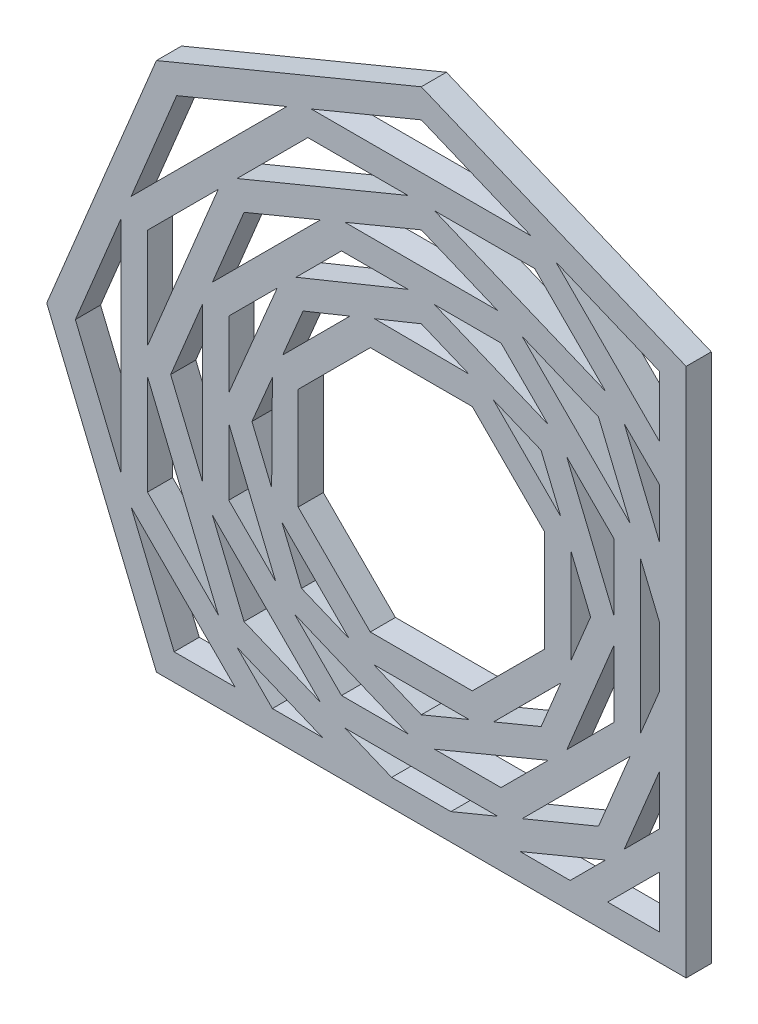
SolidWorks part; units mm, degrees
ref_plane "Front Plane" through (0, 0, 0) normal (0, 0, 1) x (1, 0, 0)
ref_plane "Top Plane" through (0, 0, 0) normal (0, 1, 0) x (1, 0, 0)
ref_plane "Right Plane" through (0, 0, 0) normal (1, 0, 0) x (0, 0, -1)
sketch "Sketch1" plane through (0, 0, 0) normal (0, 0, 1) x (1, 0, 0)
  line L54 (-570.6141, 528.2053) -> (-770.6141, 445.3626)
  line L216 (-770.6141, 445.3626) -> (-853.4568, 245.3626)
  line L270 (-853.4568, 245.3626) -> (-770.6141, 45.3626)
  line L278 (-370.6141, 445.3626) -> (-370.6141, 45.3626)
  line L286 (-770.6141, 45.3626) -> (-370.6141, 45.3626)
  line L303 (-370.6141, 445.3626) -> (-570.6141, 528.2053)
extrude "Boss-Extrude3" add sketch "Sketch1" along normal blind 19
sketch "Sketch2" plane through (0, 0, 19) normal (0, 0, 1) x (1, 0, 0)
  line L1 (-532.0943, 338.3279) -> (-609.1141, 338.3316)
  line L2 (-609.1141, 338.3316) -> (-663.5779, 283.8729)
  line L3 (-663.5779, 283.8729) -> (-663.5815, 206.8531)
  line L4 (-663.5815, 206.8531) -> (-609.1229, 152.3893)
  line L5 (-609.1229, 152.3893) -> (-532.1031, 152.3856)
  line L6 (-532.1031, 152.3856) -> (-477.6393, 206.8443)
  line L7 (-789.731, 143.7775) -> (-757.2505, 65.3626)
  line L8 (-477.6393, 206.8443) -> (-477.6356, 283.8641)
  line L9 (-477.6356, 283.8641) -> (-532.0943, 338.3279)
  line L10 (-412.8933, 169.2086) -> (-494.4601, 87.6417)
  line L11 (-630.8302, 390.7371) -> (-580.6141, 390.7371)
  line L12 (-680.4805, 149.6383) -> (-715.9886, 185.1465)
  line L13 (-465.2093, 191.0436) -> (-480.0941, 155.049)
  line L15 (-757.2505, 65.3626) -> (-711.3162, 65.3626)
  line L16 (-429.912, 65.3626) -> (-390.6141, 65.3626)
  line L17 (-431.4763, 92.0826) -> (-495.9842, 65.3626)
  line L18 (-436.7836, 111.5321) -> (-494.4601, 87.6417)
  line L19 (-510.398, 390.7371) -> (-474.8899, 355.229)
  line L20 (-570.5915, 373.2221) -> (-534.6332, 358.3276)
  line L21 (-659.8913, 336.92) -> (-624.4913, 351.271)
  line L22 (-797.3847, 328.4701) -> (-797.3847, 162.2551)
  line L23 (-672.1992, 464.4795) -> (-755.3068, 430.0553)
  line L24 (-759.879, 245.3626) -> (-735.9886, 303.039)
  line L25 (-709.7519, 92.0826) -> (-683.0319, 65.3626)
  line L26 (-412.8933, 169.2086) -> (-436.7836, 111.5321)
  line L27 (-728.335, 321.5166) -> (-704.4446, 379.1931)
  line L28 (-605.9776, 358.837) -> (-570.5915, 373.2221)
  line L30 (-390.6141, 357.7804) -> (-417.3341, 384.5004)
  line L31 (-777.3847, 159.7154) -> (-723.8941, 106.2248)
  line L32 (-672.1992, 464.4795) -> (-789.731, 346.9477)
  line L33 (-777.3847, 331.0098) -> (-777.3847, 255.3626)
  line L34 (-709.7519, 398.6426) -> (-580.6141, 452.1332)
  line L35 (-723.8941, 106.2248) -> (-777.3847, 235.3626)
  line L36 (-777.3847, 235.3626) -> (-777.3847, 159.7154)
  line L37 (-480.0941, 155.049) -> (-516.1165, 140.1033)
  line L38 (-516.1566, 350.6744) -> (-465.2981, 299.811)
  line L39 (-605.9916, 358.8711) -> (-534.633, 358.3281)
  line L40 (-675.9344, 190.9256) -> (-675.9348, 190.9254)
  line L41 (-570.6141, 506.5575) -> (-653.7216, 472.1332)
  line L42 (-429.912, 65.3626) -> (-390.6141, 104.6605)
  line L43 (-417.3341, 384.5004) -> (-390.6141, 319.9925)
  line L44 (-390.6141, 222.9952) -> (-405.2396, 187.6861)
  line L45 (-715.9886, 185.1465) -> (-715.9886, 235.3626)
  line L46 (-474.7891, 135.597) -> (-560.6141, 99.9881)
  line L47 (-665.2269, 356.3404) -> (-630.8302, 390.7371)
  line L48 (-457.5986, 209.4479) -> (-457.5665, 209.4345)
  line L49 (-487.5066, 472.1332) -> (-570.6141, 506.5575)
  line L50 (-512.9377, 79.9881) -> (-628.2906, 79.9881)
  line L51 (-425.2396, 305.5787) -> (-425.2396, 255.3626)
  line L52 (-405.2396, 303.039) -> (-390.6141, 267.73)
  line L53 (-465.2093, 191.0436) -> (-516.1033, 140.0711)
  line L54 (-625.0593, 140.0457) -> (-661.031, 154.9457)
  line L55 (-679.3118, 342.3388) -> (-679.2704, 342.2969)
  line L56 (-777.3847, 255.3626) -> (-723.8941, 384.5004)
  line L57 (-646.7681, 87.6417) -> (-704.4446, 111.5321)
  line L58 (-580.6141, 99.9881) -> (-666.3384, 135.4962)
  line L59 (-683.5877, 209.4022) -> (-683.045, 281.9239)
  line L60 (-665.2269, 356.3404) -> (-580.6141, 390.7371)
  line L62 (-390.6141, 170.7326) -> (-390.6141, 132.9448)
  line L63 (-656.2613, 452.1332) -> (-709.7519, 398.6426)
  line L64 (-704.4446, 379.1931) -> (-646.7681, 403.0834)
  line L65 (-510.398, 99.9881) -> (-560.6141, 99.9881)
  line L66 (-570.6122, 117.493) -> (-606.5828, 132.3925)
  line L67 (-625.0593, 140.0457) -> (-675.9348, 190.9254)
  line L68 (-457.6452, 281.3342) -> (-442.7461, 245.3645)
  line L70 (-728.335, 321.5166) -> (-646.7681, 403.0834)
  line L71 (-628.2906, 410.7371) -> (-512.9377, 410.7371)
  line L72 (-723.8941, 384.5004) -> (-777.3847, 331.0098)
  line L73 (-661.031, 154.9457) -> (-675.9344, 190.9256)
  line L74 (-675.3378, 300.3792) -> (-624.4913, 351.271)
  line L75 (-460.7477, 341.0868) -> (-425.2396, 305.5787)
  line L76 (-683.5877, 209.4022) -> (-698.4914, 245.383)
  line L78 (-494.4601, 403.0834) -> (-412.8933, 321.5166)
  line L79 (-390.6141, 170.7326) -> (-417.3341, 106.2248)
  line L80 (-735.9886, 187.6861) -> (-735.9886, 303.039)
  line L81 (-560.6141, 390.7371) -> (-474.8899, 355.229)
  line L82 (-628.2906, 410.7371) -> (-570.6141, 434.6275)
  line L83 (-516.1165, 140.1033) -> (-516.1033, 140.0711)
  line L84 (-484.9669, 452.1332) -> (-560.6141, 452.1332)
  line L85 (-390.6141, 357.7804) -> (-390.6141, 319.9925)
  line L86 (-534.633, 358.3281) -> (-534.6332, 358.3276)
  line L87 (-417.3341, 106.2248) -> (-390.6141, 132.9448)
  line L88 (-715.9886, 305.5787) -> (-679.2704, 342.2969)
  line L89 (-715.9886, 255.3626) -> (-715.9886, 305.5787)
  line L90 (-460.7476, 149.6385) -> (-460.7062, 149.5966)
  line L91 (-534.5118, 132.4711) -> (-570.6122, 117.493)
  line L92 (-831.809, 245.3626) -> (-797.3847, 162.2551)
  line L94 (-390.6141, 431.999) -> (-390.6141, 386.0647)
  line L95 (-390.6141, 386.0647) -> (-469.029, 464.4795)
  line L96 (-570.6141, 434.6275) -> (-512.9377, 410.7371)
  line L97 (-704.4446, 111.5321) -> (-728.335, 169.2086)
  line L98 (-580.6141, 452.1332) -> (-656.2613, 452.1332)
  line L99 (-425.2396, 235.3626) -> (-460.7062, 149.5966)
  line L100 (-534.5118, 132.4711) -> (-606.583, 132.3921)
  line L101 (-487.5066, 472.1332) -> (-653.7216, 472.1332)
  line L102 (-495.9842, 65.3626) -> (-458.1963, 65.3626)
  line L103 (-431.4763, 398.6426) -> (-484.9669, 452.1332)
  line L104 (-675.3378, 300.3792) -> (-675.3058, 300.3658)
  line L105 (-735.9886, 187.6861) -> (-759.879, 245.3626)
  line L106 (-580.6141, 99.9881) -> (-630.8302, 99.9881)
  line L107 (-606.5828, 132.3925) -> (-606.583, 132.3921)
  line L108 (-683.0319, 65.3626) -> (-645.2441, 65.3626)
  line L109 (-458.1963, 65.3626) -> (-431.4763, 92.0826)
  line L110 (-645.2441, 65.3626) -> (-709.7519, 92.0826)
  line L111 (-405.2396, 303.039) -> (-405.2396, 187.6861)
  line L112 (-512.9377, 79.9881) -> (-548.2467, 65.3626)
  line L113 (-715.9886, 255.3626) -> (-679.3118, 342.3388)
  line L114 (-675.3058, 300.3658) -> (-659.8913, 336.92)
  line L115 (-474.7891, 135.597) -> (-510.398, 99.9881)
  line L116 (-698.4914, 245.383) -> (-683.045, 281.9239)
  line L117 (-755.3068, 430.0553) -> (-789.731, 346.9477)
  line L118 (-390.6141, 104.6605) -> (-390.6141, 65.3626)
  line L119 (-560.6141, 452.1332) -> (-431.4763, 398.6426)
  line L120 (-592.9815, 65.3626) -> (-628.2906, 79.9881)
  line L121 (-425.2396, 185.1465) -> (-460.7476, 149.6385)
  line L122 (-442.7461, 245.3645) -> (-457.5986, 209.4479)
  line L123 (-480.1972, 335.7795) -> (-465.2985, 299.8108)
  line L124 (-390.6141, 267.73) -> (-390.6141, 222.9952)
  line L125 (-797.3847, 328.4701) -> (-831.809, 245.3626)
  line L126 (-465.2981, 299.811) -> (-465.2985, 299.8108)
  line L127 (-605.9916, 358.8711) -> (-605.9776, 358.837)
  line L128 (-460.7477, 341.0868) -> (-425.2396, 255.3626)
  line L129 (-494.4601, 403.0834) -> (-436.7836, 379.1931)
  line L130 (-457.6452, 281.3342) -> (-457.5665, 209.4345)
  line L131 (-390.6141, 431.999) -> (-469.029, 464.4795)
  line L132 (-789.731, 143.7775) -> (-711.3162, 65.3626)
  line L133 (-592.9815, 65.3626) -> (-548.2467, 65.3626)
  line L134 (-436.7836, 379.1931) -> (-412.8933, 321.5166)
  line L135 (-646.7681, 87.6417) -> (-728.335, 169.2086)
  line L136 (-630.8302, 99.9881) -> (-666.3384, 135.4962)
  line L137 (-680.4805, 149.6383) -> (-715.9886, 235.3626)
  line L138 (-425.2396, 235.3626) -> (-425.2396, 185.1465)
  line L139 (-560.6141, 390.7371) -> (-510.398, 390.7371)
  line L140 (-516.1566, 350.6744) -> (-480.1972, 335.7795)
  circle A0 centre (-570.6086, 245.3586) radius 92.9711 construction
extrude "Cut-Extrude4" cut sketch "Sketch2" against normal blind 32 contours L101 L49 L41 | L139 L81 L19 | L23 L117 L32 | L56 L72 L33 | L89 L113 L88 | L138 L99 L121 | L68 L130 L122 | L140 L38 L123 | L28 L39 L20 | L114 L74 L21 | L73 L54 L67 | L91 L100 L66 | L13 L53 L37 | L80 L24 L105 | L59 L116 L76 | L35 L36 L31 | L132 L15 L7 | L110 L25 L108 | L135 L97 L57 | L106 L136 L58 | L50 L120 L133 L112 | L46 L65 L115 | L17 L102 L109 | L42 L118 L16 | L79 L87 L62 | L10 L18 L26 | L70 L64 L27 | L34 L98 L63 | L22 L92 L125 | L137 L45 L12 | L60 L11 L47 | L71 L96 L82 | L78 L134 L129 | L75 L51 L128 | L1 L2 L3 L4 L5 L6 L8 L9 | L95 L131 L94 | L119 L103 L84 | L85 L43 L30 | L124 L44 L111 L52
scale "Scale1" scale about centroid uniform scaling yes scale factor 0.757143
